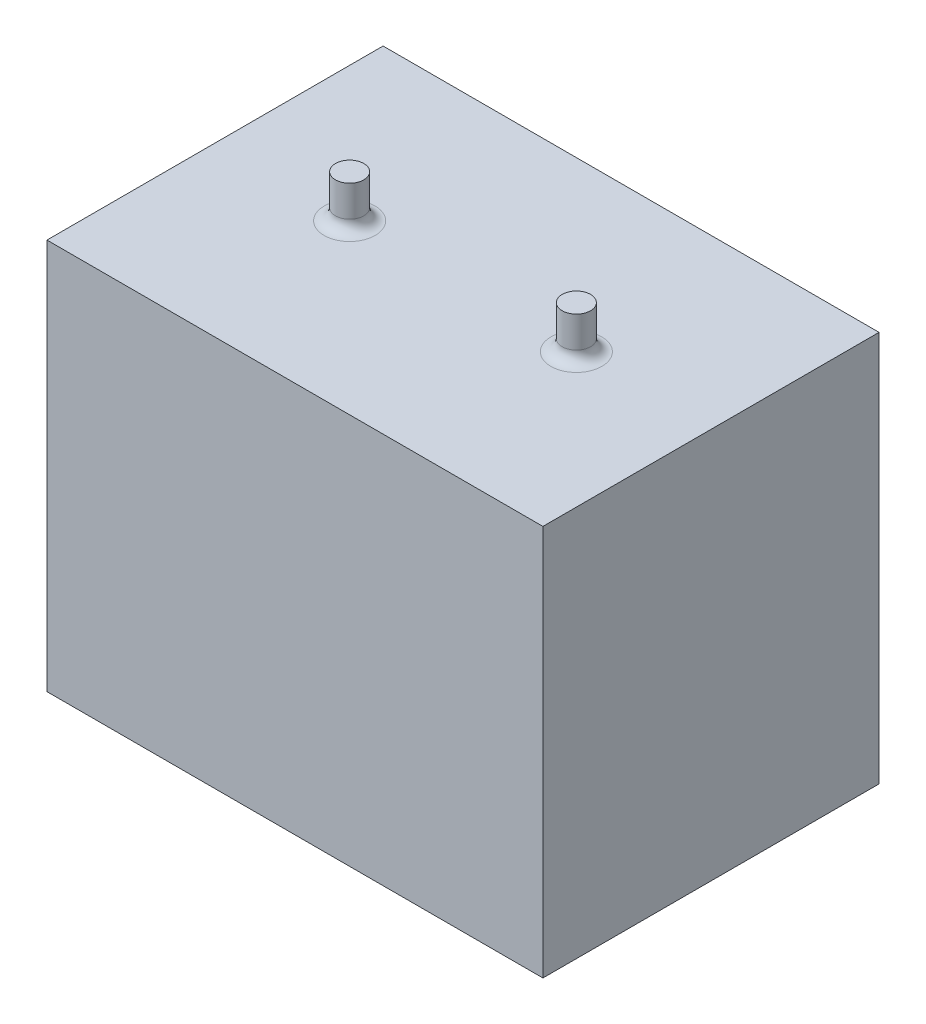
SolidWorks part; units mm, degrees
ref_plane "Front Plane" through (0, 0, 0) normal (0, 0, 1) x (1, 0, 0)
ref_plane "Top Plane" through (0, 0, 0) normal (0, 1, 0) x (1, 0, 0)
ref_plane "Right Plane" through (0, 0, 0) normal (1, 0, 0) x (0, 0, -1)
sketch "Sketch1" plane through (0, 0, 0) normal (0, 0, 1) x (1, 0, 0)
  line L1 (0, 0) -> (222.25, 0)
  line L2 (0, 0) -> (0, 175.26)
  line L3 (0, 175.26) -> (222.25, 175.26)
  line L4 (222.25, 0) -> (222.25, 175.26)
  dimension "D1" = 222.25
  dimension "D2" = 175.26
extrude "Boss-Extrude1" add sketch "Sketch1" along normal blind 150.622
sketch "Sketch2" plane through (0, 175.26, 0) normal (0, 1, 0) x (1, 0, 0)
  line L0 (60.325, -75.311) -> (0, -75.311) construction
  line L1 (0, -150.622) -> (0, 0) construction
  line L2 (60.325, -75.311) -> (161.925, -75.311) construction
  line L3 (111.125, -75.311) -> (111.125, 0) construction
  line L4 (222.25, 0) -> (0, 0) construction
  circle A0 centre (60.325, -75.311) radius 6.35
  circle A1 centre (161.925, -75.311) radius 6.35
  dimension "D1" = 12.7
  dimension "D2" = 60.325
extrude "Boss-Extrude2" add sketch "Sketch2" along normal blind 19.05
fillet "Fillet1" radius 5.08 1 edges at (60.325, 175.26, 68.961)
fillet "Fillet2" radius 5.08 1 edges at (161.925, 175.26, 68.961)
